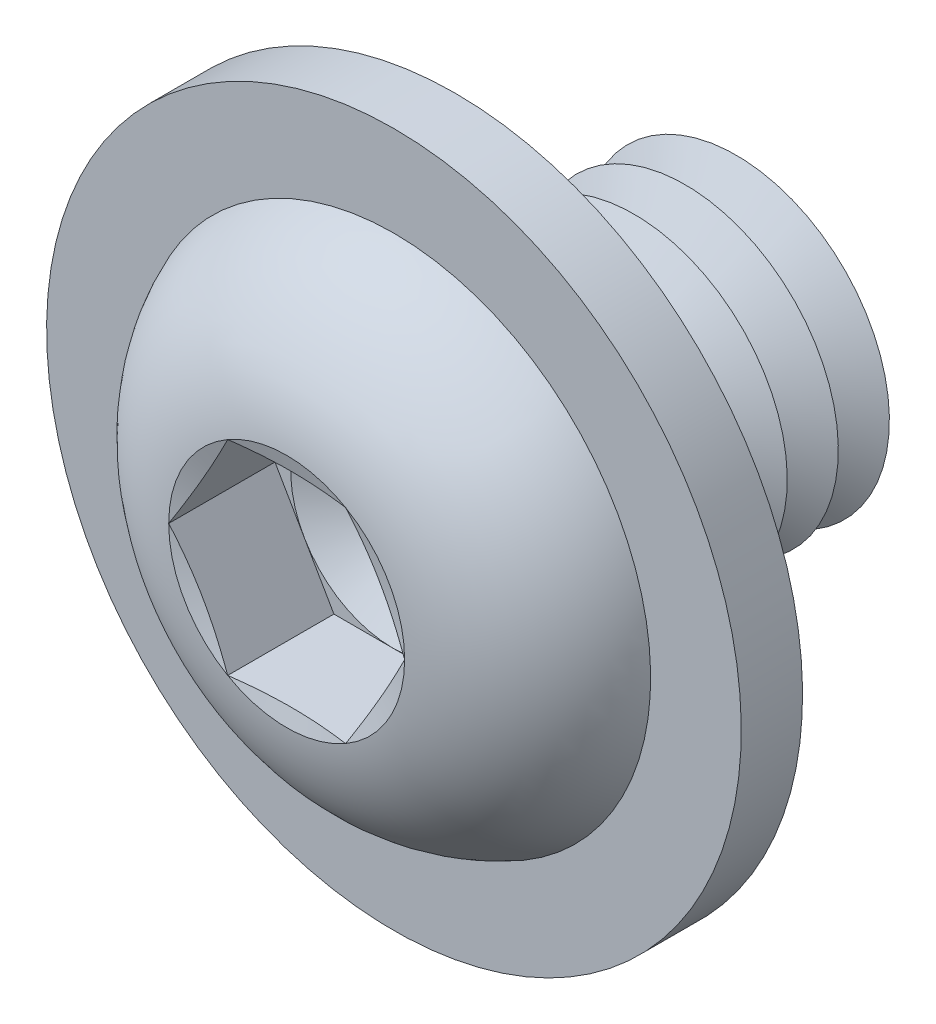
SolidWorks part; units mm, degrees
ref_plane "Front Plane" through (0, 0, 0) normal (0, 0, 1) x (1, 0, 0)
ref_plane "Top Plane" through (0, 0, 0) normal (0, 1, 0) x (1, 0, 0)
ref_plane "Right Plane" through (0, 0, 0) normal (1, 0, 0) x (0, 0, -1)
sketch "Sketch1" plane through (0, 0, 0) normal (1, 0, 0) x (0, 0, -1)
  line L0 (0, 3) -> (0, 5.25)
  line L3 (0, 3) -> (6, 3)
  line L4 (6, 3) -> (6, 0)
  line L5 (6, 0) -> (-3.3, 0) construction
  line L6 (-3.3, 0) -> (6, 0)
  line L7 (-3.3, 2.3094) -> (-3.3, 1.1547) construction
  line L8 (-3.3, 1.1547) -> (-3.3, 0)
  line L9 (-3.3, 2.3094) -> (-2.9906, 1.1547)
  line L10 (-2.9906, 1.1547) -> (-3.3, 1.1547)
  line L11 (6, 0) -> (22.7481, 0) construction
  line L12 (0, 5.25) -> (-3.3, 5.25) construction
  arc A1 (0, 5.25) -> (-3.3, 2.3094) centre (0, 1.928) ccw
  point P8 (6, 1.5)
  dimension "D1" = 10.5
  dimension "D2" = 6
  dimension "D3" = 3.3
  dimension "D4" = 4.6188
  dimension "D5" = 6
  dimension "D6" = 15
revolve "Revolve1" add sketch "Sketch1" angle 360 about L5
fillet "Fillet1" radius 0.5 1 edges at (0, 3, 0)
sketch "Sketch2" plane through (0, 0, 0) normal (1, 0, 0) x (0, 0, -1)
  line L0 (5.5, 3) -> (6.5, 3)
  line L1 (6, 3) -> (0.5, 3) construction
  line L2 (6.5, 3) -> (6, 2.134)
  line L3 (6, -3) -> (6, 3) construction
  line L4 (6, 2.134) -> (5.5, 3)
  dimension "D1" = 1
revolve "Cut-Revolve1" cut sketch "Sketch2" angle 360 about axis through (0, 0, -6) along (0, 0, -1)
pattern_linear "LPattern1" count 6 spacing 1 along (0, 0, 1) of "Cut-Revolve1"
sketch "Sketch3" plane through (0, 0, 3.3) normal (0, 0, 1) x (1, 0, 0)
  line L7 (1.1547, 2) -> (-1.1547, 2)
  line L8 (-1.1547, 2) -> (-2.3094, 0)
  line L9 (-2.3094, 0) -> (-1.1547, -2)
  line L10 (-1.1547, -2) -> (1.1547, -2)
  line L11 (1.1547, -2) -> (2.3094, 0)
  line L12 (2.3094, 0) -> (1.1547, 2)
  circle A0 centre (0, 0) radius 2 construction
  circle A3 centre (0, 0) radius 2.3094 construction
extrude "Cut-Extrude1" cut sketch "Sketch3" against normal blind 2.08
sketch "Sketch4" plane through (0, 0, 1.22) normal (0, 0, 1) x (1, 0, 0)
  line L1 (1.1547, 2) -> (-1.1547, 2) construction
  circle A0 centre (0, 0) radius 2
extrude "Cut-Extrude2" cut sketch "Sketch4" against normal through all draft 60
sketch "Sketch5" plane through (0, 0, 0) normal (0, 0, -1) x (-1, 0, 0)
  circle A0 centre (0, 0) radius 6.8
  circle A1 centre (0, 0) radius 3.5
  circle A2 centre (0, 0) radius 3.5 construction
  dimension "D1" = 13.6
extrude "Boss-Extrude1" add sketch "Sketch5" against normal blind 1.2
